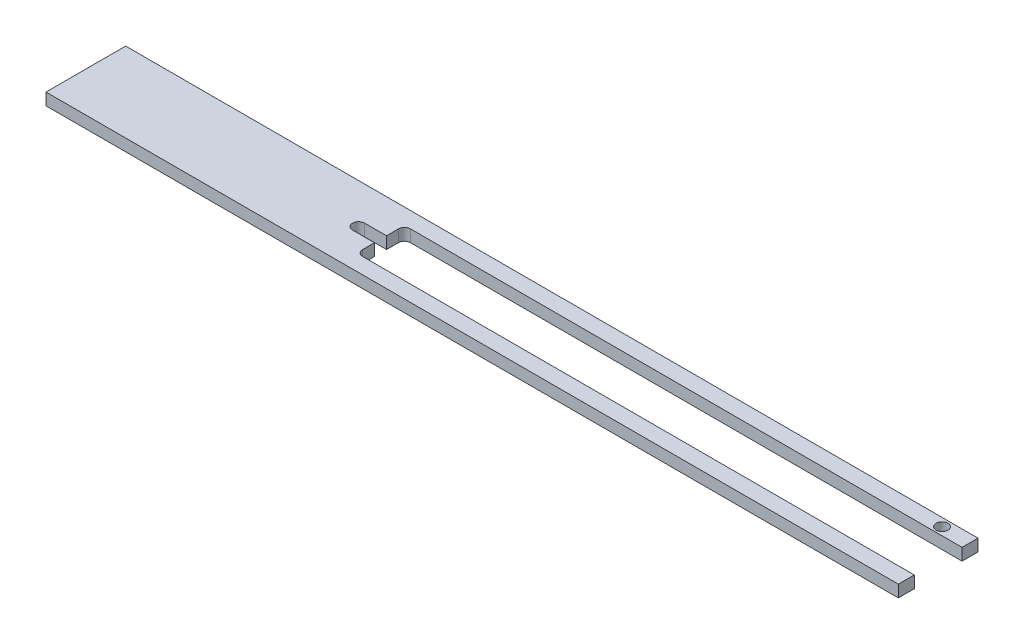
SolidWorks part; units mm, degrees
ref_plane "Спереди" through (0, 0, 0) normal (0, 0, 1) x (1, 0, 0)
ref_plane "Сверху" through (0, 0, 0) normal (0, 1, 0) x (1, 0, 0)
ref_plane "Справа" through (0, 0, 0) normal (1, 0, 0) x (0, 0, -1)
sketch "Эскиз1" plane through (0, 0, 0) normal (0, 1, 0) x (1, 0, 0)
  line L0 (55.4579, 3.1196) -> (-13.7921, 3.1196)
  line L2 (-51.5421, 5.1196) -> (-51.5421, -4.8804)
  line L4 (55.4579, 5.1196) -> (55.4579, 3.1196)
  line L5 (55.4579, -2.8804) -> (-13.7921, -2.8804)
  line L6 (-14.5421, 2.3696) -> (-14.5421, 0.8696)
  line L10 (-14.5421, -0.6447) -> (-14.5421, -2.1304)
  line L12 (-14.5421, 0.8696) -> (-17.2921, 0.8696)
  line L14 (-51.5421, 5.1196) -> (55.4579, 5.1196)
  line L15 (-51.5421, -4.8804) -> (55.4579, -4.8804)
  line L17 (55.4579, -2.8804) -> (55.4579, -4.8804)
  line L18 (-14.5421, -0.6447) -> (-17.2921, -0.6447)
  circle A2 centre (51.9579, 4.1053) radius 0.75
  arc A3 (-13.7921, -2.8804) -> (-14.5421, -2.1304) centre (-13.7921, -2.1304) cw
  arc A4 (-13.7921, 3.1196) -> (-14.5421, 2.3696) centre (-13.7921, 2.3696) ccw
  arc A9 (-17.2921, 0.8696) -> (-17.2921, -0.6447) centre (-17.2921, 0.1124) ccw
  dimension "D19" = 1.5
  dimension "D20" = 3.5
  dimension "D21" = 0.75
  dimension "D1" = 10
  dimension "D3" = 70
  dimension "D5" = 37
  dimension "D10" = 2.75
  dimension "D12" = 4.25
extrude "Бобышка-Вытянуть1" add sketch "Эскиз1" along normal blind 1.5
